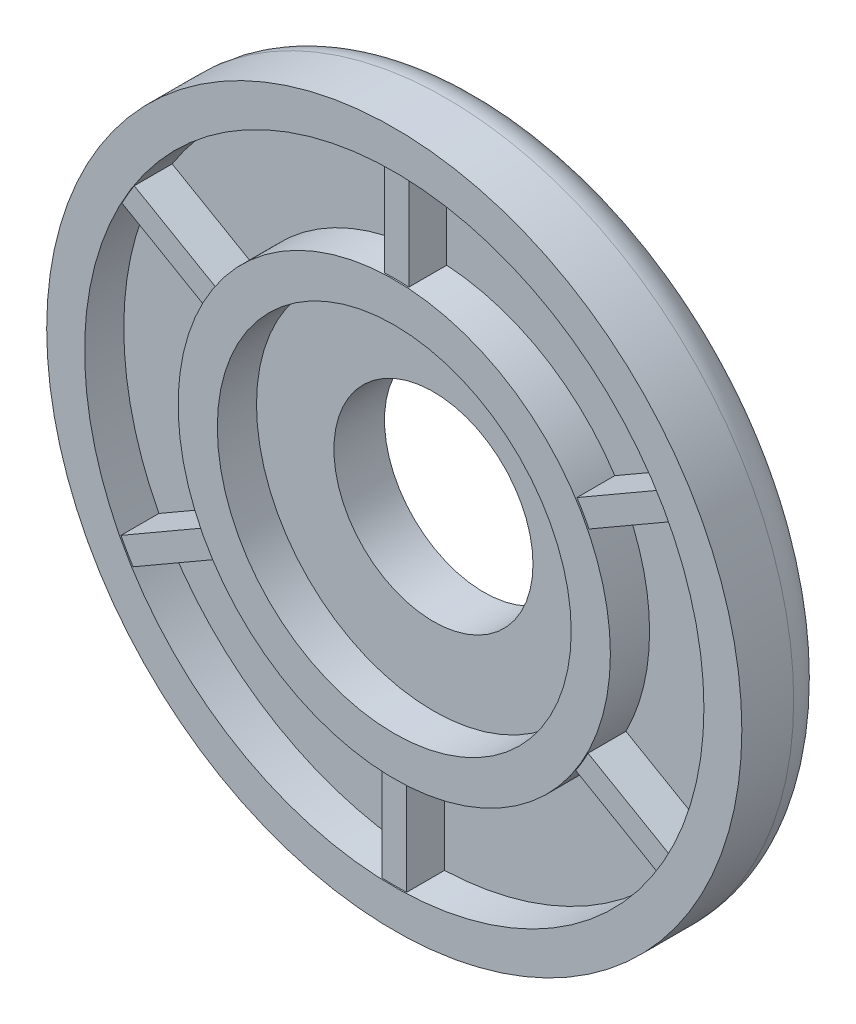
SolidWorks part; units mm, degrees
ref_plane "Спереди" through (0, 0, 0) normal (0, 0, 1) x (1, 0, 0)
ref_plane "Сверху" through (0, 0, 0) normal (0, 1, 0) x (1, 0, 0)
ref_plane "Справа" through (0, 0, 0) normal (1, 0, 0) x (0, 0, -1)
other "Configuration Table"
sketch "Эскиз1" plane through (0, 0, 0) normal (0, 0, 1) x (1, 0, 0)
  circle A0 centre (0, 0) radius 27.5
  circle A1 centre (0, 0) radius 7.875
  dimension "D1" = 55
  dimension "D2" = 15.75
extrude "Бобышка-Вытянуть1" add sketch "Эскиз1" along normal blind 4
sketch "Эскиз2" plane through (0, 0, 4) normal (0, 0, 1) x (1, 0, 0)
  circle A0 centre (0, 0) radius 27.5
  circle A1 centre (0, 0) radius 24.5
  circle A2 centre (0, 0) radius 17.1
  circle A3 centre (0, 0) radius 14
  dimension "D1" = 55
  dimension "D2" = 49
  dimension "D3" = 34.2
  dimension "D4" = 28
extrude "Бобышка-Вытянуть2" add sketch "Эскиз2" along normal blind 3.1 and the other way blind 3.1 contours A1 M3 | A2 A3
sketch "Эскиз4" plane through (0, 0, 4) normal (0, 0, 1) x (1, 0, 0)
  line L0 (0, 35.1842) -> (0, -39.1076) construction
  line L1 (-0.8785, 24.9307) -> (-0.8785, 16.6554)
  line L2 (-0.8785, 16.6554) -> (1.0515, 16.6554)
  line L3 (1.0515, 16.6554) -> (1.0515, 24.9307)
  line L4 (1.0515, 24.9307) -> (-0.8785, 24.9307)
  line L5 (22.1163, 11.5548) -> (21.1513, 13.2262)
  line L6 (21.1513, 13.2262) -> (13.9848, 9.0886)
  line L7 (13.9848, 9.0886) -> (14.9498, 7.4171)
  line L8 (14.9498, 7.4171) -> (22.1163, 11.5548)
  line L9 (21.0649, -13.3759) -> (22.0299, -11.7045)
  line L10 (22.0299, -11.7045) -> (14.8633, -7.5669)
  line L11 (14.8633, -7.5669) -> (13.8983, -9.2383)
  line L12 (13.8983, -9.2383) -> (21.0649, -13.3759)
  line L13 (-1.0515, -24.9307) -> (0.8785, -24.9307)
  line L14 (0.8785, -24.9307) -> (0.8785, -16.6554)
  line L15 (0.8785, -16.6554) -> (-1.0515, -16.6554)
  line L16 (-1.0515, -16.6554) -> (-1.0515, -24.9307)
  line L17 (-22.1163, -11.5548) -> (-21.1513, -13.2262)
  line L18 (-21.1513, -13.2262) -> (-13.9848, -9.0886)
  line L19 (-13.9848, -9.0886) -> (-14.9498, -7.4171)
  line L20 (-14.9498, -7.4171) -> (-22.1163, -11.5548)
  line L21 (-21.0649, 13.3759) -> (-22.0299, 11.7045)
  line L22 (-22.0299, 11.7045) -> (-14.8633, 7.5669)
  line L23 (-14.8633, 7.5669) -> (-13.8983, 9.2383)
  line L24 (-13.8983, 9.2383) -> (-21.0649, 13.3759)
  point P30 (0, 0)
  dimension "D1" = 1.93
extrude "Бобышка-Вытянуть6" add sketch "Эскиз4" along normal blind 3
fillet "Скругление1" radius 3 1 edges at (27.5, 0, 0)
